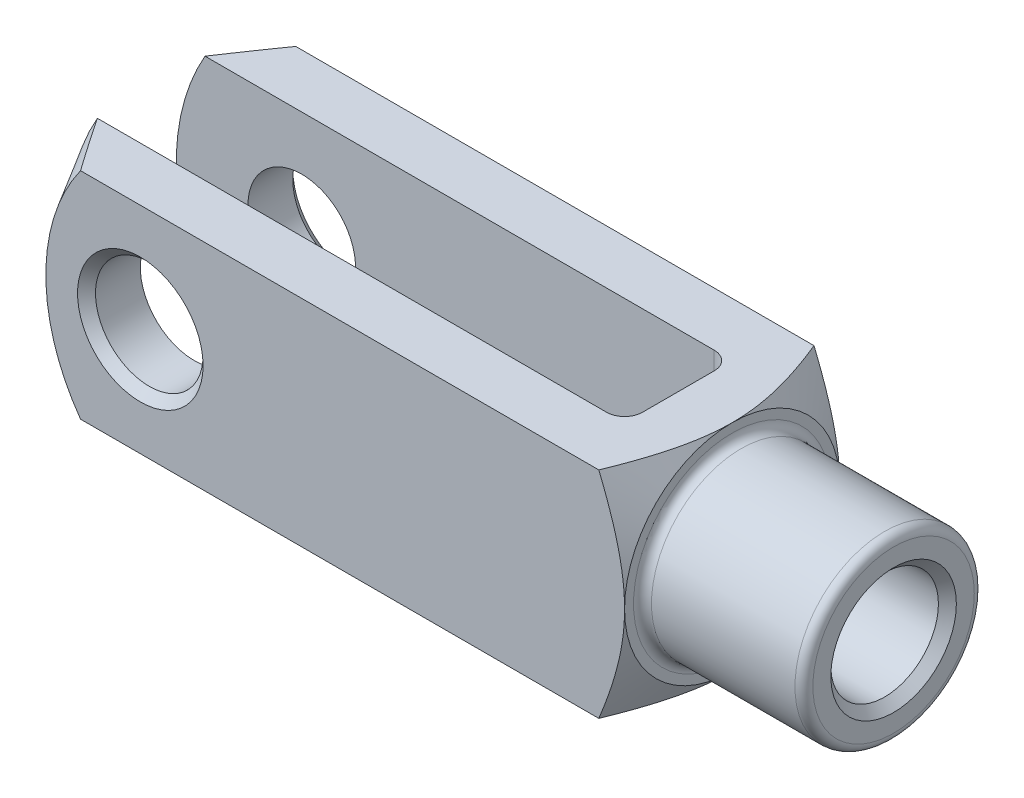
SolidWorks part; units mm, degrees
ref_plane "Front Plane" through (0, 0, 0) normal (0, 0, 1) x (1, 0, 0)
ref_plane "Top Plane" through (0, 0, 0) normal (0, 1, 0) x (1, 0, 0)
ref_plane "Right Plane" through (0, 0, 0) normal (1, 0, 0) x (0, 0, -1)
sketch "Sketch1" plane through (0, 0, 0) normal (1, 0, 0) x (0, 0, -1)
  line L0 (0, 0) -> (0, 50000) construction
  line L1 (0, 0) -> (50000, 0) construction
  line L2 (-6, -6) -> (-6, 6)
  line L3 (-6, 6) -> (6, 6)
  line L4 (6, -6) -> (6, 6)
  line L5 (-6, -6) -> (6, -6)
  point P9 (0, 6)
  point P11 (6, 0)
  point P12 (-6, 0)
  dimension "D1" = 12
  dimension "D2" = 12
extrude "Extrude1" add sketch "Sketch1" against normal blind 43
sketch "Sketch2" plane through (0, 0, 0) normal (1, 0, 0) x (0, 0, -1)
  circle A0 centre (0, 0) radius 5
  circle A1 centre (0, 0) radius 10
  dimension "D1" = 10
  dimension "D2" = 20
extrude "Extrude2" cut sketch "Sketch2" against normal blind 9
sketch "Sketch3" plane through (0, 0, 6) normal (0, 0, 1) x (1, 0, 0)
  circle A0 centre (-36, 0) radius 3
  dimension "D1" = 6
  dimension "D2" = 36
extrude "Extrude3" cut sketch "Sketch3" against normal through all
sketch "Sketch4" plane through (0, 6, 0) normal (0, 1, 0) x (1, 0, 0)
  line L0 (0, 0) -> (-50000, 0) construction
  line L1 (-43, -3) -> (-43, 3)
  line L2 (-43, 6) -> (-43, -6) construction
  line L3 (-43, 3) -> (-12, 3)
  line L4 (-12, 3) -> (-12, -3)
  line L5 (-36, 6) -> (-36, -6) construction
  line L6 (-43, -3) -> (-12, -3)
  point P7 (-36, 0)
  point P13 (-12, 0)
  point P14 (-43, 0)
  dimension "D1" = 24
  dimension "D2" = 6
extrude "Extrude4" cut sketch "Sketch4" against normal through all
fillet "Fillet1" radius 1 2 edges at (-12, 0, 3) (-12, 0, -3)
fillet "Fillet2" radius 0.5 2 edges at (0, 0, -5) (-9, 0, -5)
chamfer "Chamfer2" distance 0.5 angle 45 2 edges at (-33, 0, -6) (-33, 0, 6)
sketch "Sketch6" plane through (0, 0, 0) normal (0, 0, 1) x (1, 0, 0)
  line L0 (-9, -6) -> (-9, -12)
  line L1 (-9, -12) -> (-12.4641, -12)
  line L2 (-12.4641, -12) -> (-9, -6)
  dimension "D1" = 30
  dimension "D2" = 12
revolve "Cut-Revolve1" cut sketch "Sketch6" angle 360 about axis through (-9, 0, 0) along (1, 0, 0)
sketch "Sketch7" plane through (0, 0, 0) normal (0, 1, 0) x (1, 0, 0)
  line L0 (-41.2679, -6) -> (-43, -3)
  line L1 (-43, 3) -> (-41.2679, 6)
  line L2 (-41.2679, 6) -> (-55, 6)
  line L3 (-43, 3) -> (-43, -3)
  line L4 (-55, 6) -> (-55, -6)
  line L5 (-55, -6) -> (-41.2679, -6)
  line L6 (-43, 6) -> (-10.4349, 6) construction
  line L7 (-43, -6) -> (-10.4349, -6) construction
  line L8 (-31, 0.6162) -> (-31, 50000.6162) construction
  dimension "D1" = 120
  dimension "D2" = 12
  dimension "D3" = 12
revolve "Cut-Revolve2" cut sketch "Sketch7" angle 180 about L8
sketch "Sketch8" plane through (0, 0, 0) normal (1, 0, 0) x (0, 0, -1)
  circle A0 centre (0, 0) radius 3
  dimension "D1" = 6
extrude "Extrude5" cut sketch "Sketch8" against normal through all
chamfer "Chamfer3" distance 0.5 angle 45 1 edges at (0, 0, -3)
equation "\"D2@Sketch1\" = \"D1@Sketch1\""
equation "\"D2@Sketch2\" = \"D1@Sketch2\"*2"
equation "\"D2@Sketch6\" = \"D1@Sketch1\""
equation "\"D2@Sketch7\" = \"D1@Sketch1\""
equation "\"D3@Sketch7\" = \"D1@Sketch1\""
